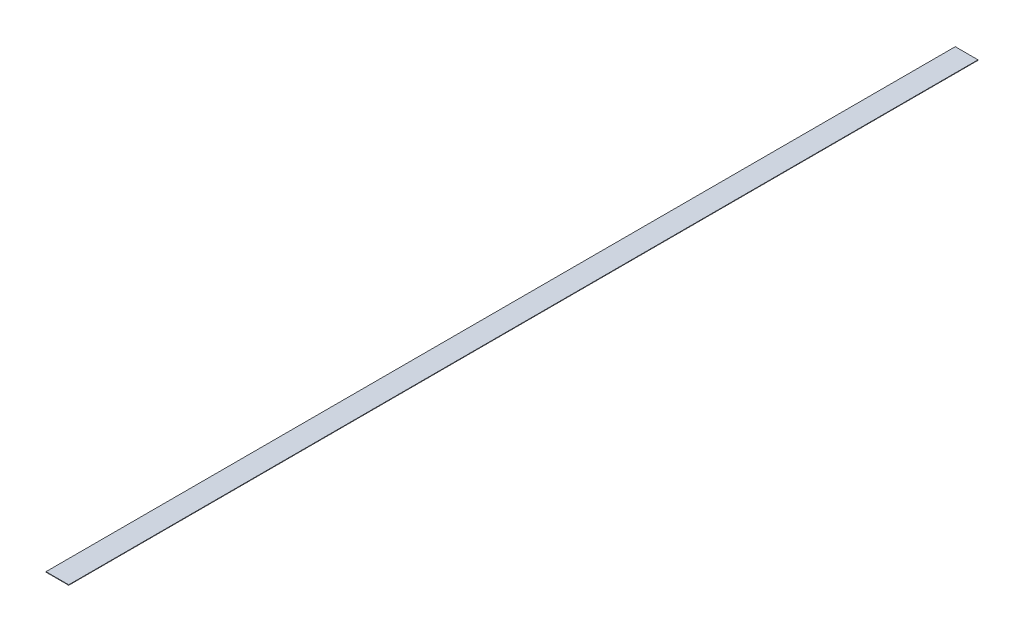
SolidWorks part; units mm, degrees
ref_plane "Front Plane" through (0, 0, 0) normal (0, 0, 1) x (1, 0, 0)
ref_plane "Top Plane" through (0, 0, 0) normal (0, 1, 0) x (1, 0, 0)
ref_plane "Right Plane" through (0, 0, 0) normal (1, 0, 0) x (0, 0, -1)
sketch "Sketch1" plane through (0, 0, 0) normal (0, 1, 0) x (1, 0, 0)
  line L1 (-76.2, 3048) -> (76.2, 3048)
  line L2 (-76.2, 3048) -> (-76.2, -3048)
  line L3 (-76.2, -3048) -> (76.2, -3048)
  line L4 (76.2, 3048) -> (76.2, -3048)
  point P4 (-76.2, 0)
  point P5 (0, 3048)
  point P6 (0, 0)
  dimension "D1" = 152.4
  dimension "D2" = 6096
extrude "Boss-Extrude1" add sketch "Sketch1" along normal blind 3.175
